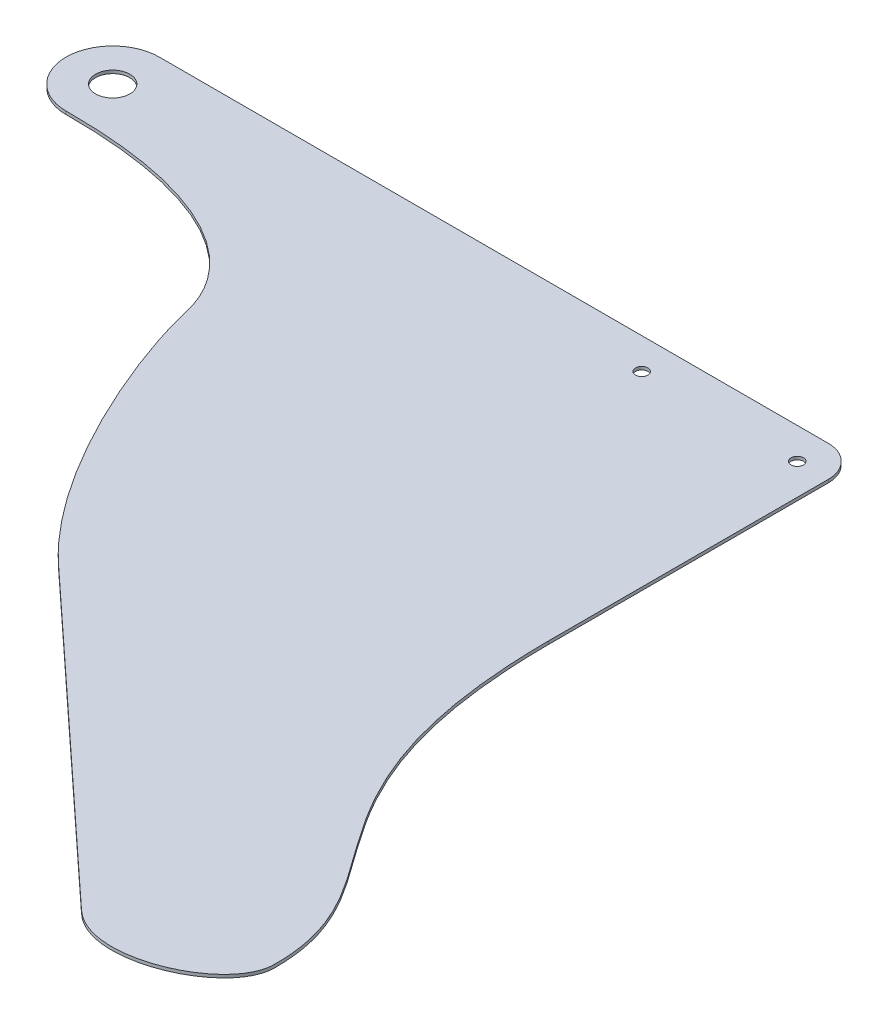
SolidWorks part; units mm, degrees
ref_plane "Plan de face" through (0, 0, 0) normal (0, 0, 1) x (1, 0, 0)
ref_plane "Plan de dessus" through (0, 0, 0) normal (0, 1, 0) x (1, 0, 0)
ref_plane "Plan de droite" through (0, 0, 0) normal (1, 0, 0) x (0, 0, -1)
sketch "Esquisse1" plane through (0, 0, 0) normal (0, 1, 0) x (1, 0, 0)
  line L0 (-140.6083, 0) -> (17.4428, 0) construction
  line L1 (-120, 15.4464) -> (-120, -20.9104) construction
  line L2 (0, 21.1355) -> (0, -170.8713) construction
  line L3 (-23.913, -125) -> (54.5761, -125) construction
  line L4 (23, -65.1594) -> (23, -134.5121) construction
  line L5 (18.8615, -117) -> (47.5162, -117) construction
  line L6 (-75, -51.0397) -> (-75, 48.4213) construction
  line L7 (-80.8071, -33) -> (-33.4645, -33) construction
  line L8 (-135, 24.127) -> (-135, -3.4895) construction
  line L9 (-135, 0) -> (0, -125) construction
  line L10 (-50, -53.3238) -> (-50, -86.1313) construction
  line L11 (-10.0009, -50) -> (58.9366, -50) construction
  line L12 (-5, 0) -> (-112.5, 0)
  line L14 (0, -5) -> (0, -50)
  line L15 (-117.5, -15) -> (-69.3834, -15) construction
  line L16 (-112.5, -7.5) -> (-112.5, 21.1355) construction
  line L17 (-50, -78.7037) -> (0, -125)
  circle A0 centre (-112.5, -7.5) radius 2.75
  circle A1 centre (-112.5, -7.5) radius 7.5 construction
  arc A2 (-112.5, 0) -> (-112.5, -15) centre (-112.5, -7.5) ccw
  arc A3 (-5, 0) -> (0, -5) centre (-5, -5) cw
  circle A4 centre (-5, -5) radius 1
  circle A5 centre (-30, -5) radius 1
  spline S0 degree 3 poles (-112.5, -15) (-86.7603, -14.8544) (-76.9117, -24.5638) (-72.6058, -43.5653) (-63.3492, -66.3039) (-50, -78.7037) knots 0 0 0 0 0.443974 0.443974 1 1 1 1
  spline S1 degree 3 poles (0, -50) (0.1512, -94.0799) (23.0531, -94.6311) (22.9818, -124.6896) (6.9681, -131.524) (0, -125) knots 0 0 0 0 0.744178 0.744178 1 1 1 1
  point P42 (0, 0)
  dimension "D1" = 5
extrude "Extrusion1" add sketch "Esquisse1" against normal blind 0.5
